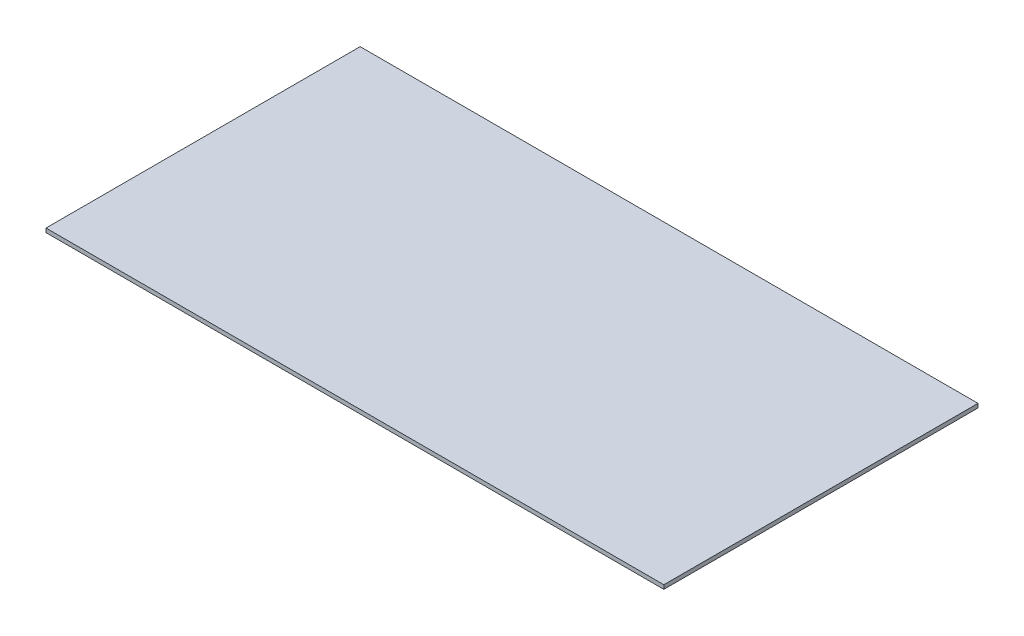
SolidWorks part; units mm, degrees
ref_plane "Front" through (0, 0, 0) normal (0, 0, 1) x (1, 0, 0)
ref_plane "Top" through (0, 0, 0) normal (0, 1, 0) x (1, 0, 0)
ref_plane "Right" through (0, 0, 0) normal (1, 0, 0) x (0, 0, -1)
sketch "Esquisse3" plane through (0, 0, 0) normal (0, 1, 0) x (1, 0, 0)
  line L0 (-1431.6389, 757.6471) -> (1652.728, 757.6471)
  line L5 (-1431.6389, 757.6471) -> (-1431.6389, -810.6456)
  line L6 (-1431.6389, -810.6456) -> (1652.728, -810.6456)
  line L7 (1652.728, 757.6471) -> (1652.728, -810.6456)
extrude "Boss.-Extru.4" add sketch "Esquisse3" along normal blind 20
